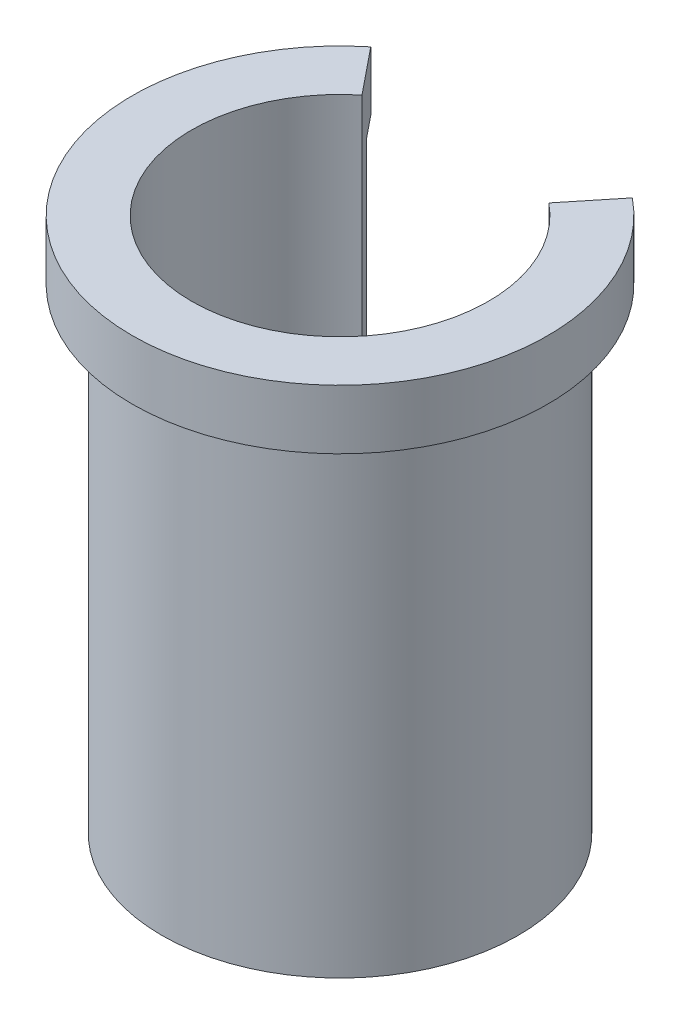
SolidWorks part; units mm, degrees
ref_plane "Front Plane" through (0, 0, 0) normal (0, 0, 1) x (1, 0, 0)
ref_plane "Top Plane" through (0, 0, 0) normal (0, 1, 0) x (1, 0, 0)
ref_plane "Right Plane" through (0, 0, 0) normal (1, 0, 0) x (0, 0, -1)
sketch "Sketch1" plane through (0, 0, 0) normal (0, 1, 0) x (1, 0, 0)
  circle A0 centre (0, 0) radius 5
  circle A1 centre (0, 0) radius 6
  dimension "D1" = 10
  dimension "D2" = 1
extrude "Extrude1" add sketch "Sketch1" along normal blind 18
sketch "Sketch2" plane through (0, 18, 0) normal (0, 1, 0) x (1, 0, 0)
  circle A0 centre (0, 0) radius 5 construction
  circle A1 centre (0, 0) radius 5
  circle A2 centre (0, 0) radius 7
  dimension "D1" = 2
extrude "Extrude2" add sketch "Sketch2" against normal blind 2
sketch "Sketch3" plane through (0, 18, 0) normal (0, 1, 0) x (1, 0, 0)
  line L0 (0, 0) -> (0, 3.9375) construction
  line L1 (4.4052, 5.44) -> (3.1466, 3.8857)
  line L2 (-4.4052, 5.44) -> (-3.1466, 3.8857)
  circle A0 centre (0, 0) radius 7 construction
  circle A1 centre (0, 0) radius 5 construction
  arc A2 (3.1466, 3.8857) -> (-3.1466, 3.8857) centre (0, 0) ccw
  arc A3 (4.4052, 5.44) -> (-4.4052, 5.44) centre (0, 0) ccw
  dimension "D1" = 78
extrude "Extrude7" cut sketch "Sketch3" against normal through all
